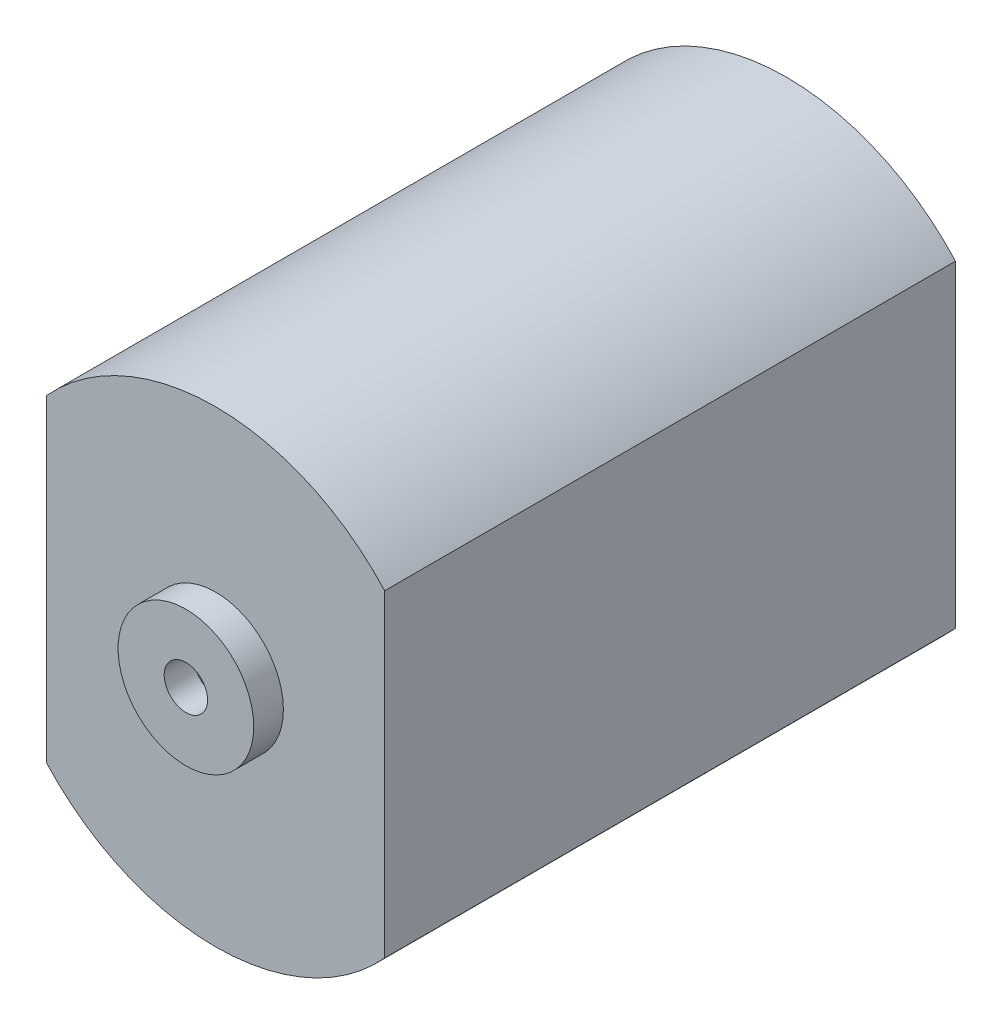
SolidWorks part; units mm, degrees
ref_plane "Front Plane" through (0, 0, 0) normal (0, 0, 1) x (1, 0, 0)
ref_plane "Top Plane" through (0, 0, 0) normal (0, 1, 0) x (1, 0, 0)
ref_plane "Right Plane" through (0, 0, 0) normal (1, 0, 0) x (0, 0, -1)
sketch "Sketch2" plane through (0, 0, 0) normal (0, 0, 1) x (1, 0, 0)
  line L0 (0, 0) -> (0, 13.93)
  line L1 (-14.81, 13.93) -> (-14.81, 0)
  arc A0 (0, 13.93) -> (-14.81, 13.93) centre (-7.405, 7.2094) ccw
  arc A1 (-14.81, 0) -> (0, 0) centre (-7.405, 6.7206) ccw
  dimension "D2" = 10
  dimension "D4" = 10
  dimension "D1" = 14.81
  dimension "D3" = 13.93
extrude "Boss-Extrude1" add sketch "Sketch2" along normal blind 25
sketch "Sketch3" plane through (0, 0, 25) normal (0, 0, 1) x (1, 0, 0)
  circle A0 centre (-7.405, 7.2094) radius 2.97
  dimension "D1" = 5.94
extrude "Boss-Extrude2" add sketch "Sketch3" along normal blind 1.3
sketch "Sketch4" plane through (0, 0, 26.3) normal (0, 0, 1) x (1, 0, 0)
  circle A0 centre (-7.405, 7.2094) radius 0.95
  dimension "D1" = 1.9
extrude "Cut-Extrude1" cut sketch "Sketch4" against normal up to surface (1.3 mm away) contours A0
